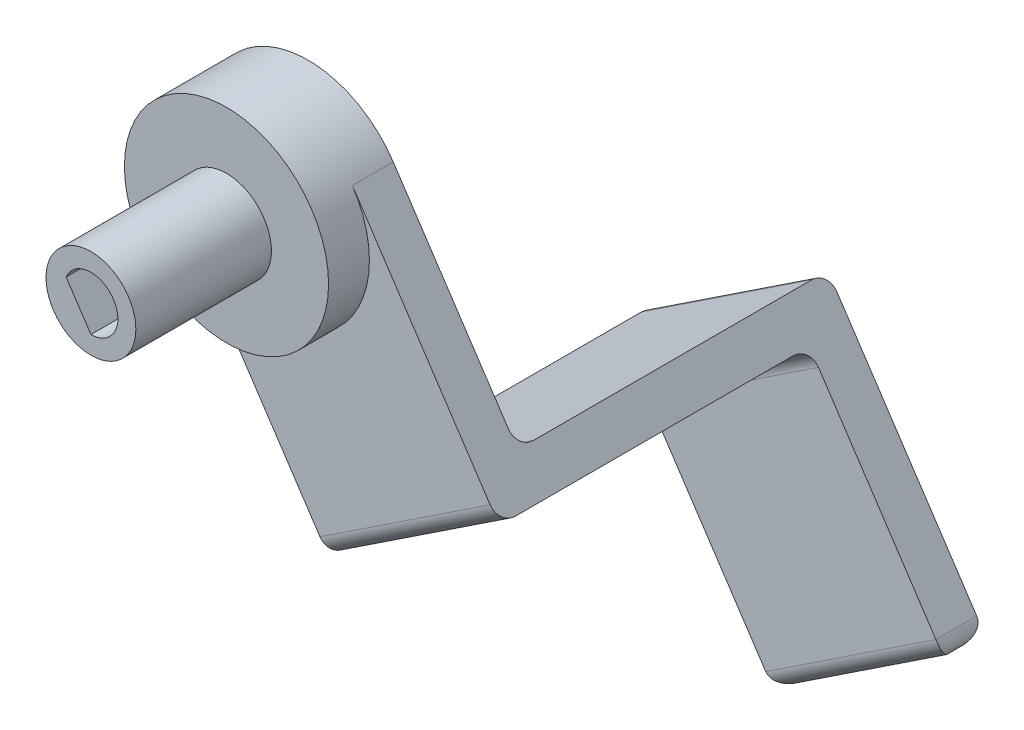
SolidWorks part; units mm, degrees
ref_plane "Front Plane" through (0, 0, 0) normal (0, 0, 1) x (1, 0, 0)
ref_plane "Top Plane" through (0, 0, 0) normal (0, 1, 0) x (1, 0, 0)
ref_plane "Right Plane" through (0, 0, 0) normal (1, 0, 0) x (0, 0, -1)
sketch "Sketch1" plane through (0, 0, 0) normal (0, 0, 1) x (1, 0, 0)
  line L0 (0, 0) -> (-3.0402, 4.5833)
  arc A0 (0, 0) -> (-3.0402, 4.5833) centre (0, 3.3) ccw
  circle A2 centre (0, 3.3) radius 5.5
  dimension "D1" = 3.3
  dimension "D3" = 11
  dimension "D2" = 5.5
extrude "Boss-Extrude1" add sketch "Sketch1" along normal blind 6.6
sketch "Sketch5" plane through (0, 0, 0) normal (0, 0, -1) x (-1, 0, 0)
  circle A0 centre (0, 3.3) radius 5.5
  dimension "D1" = 11
  dimension "D2" = 3.3
extrude "Boss-Extrude4" add sketch "Sketch5" along normal blind 10
sketch "Sketch6" plane through (0, 0, -10) normal (0, 0, -1) x (-1, 0, 0)
  circle A0 centre (0, 3.3) radius 12.5
  circle A1 centre (0, 3.3) radius 5.5 construction
  dimension "D1" = 25
extrude "Boss-Extrude5" add sketch "Sketch6" along normal blind 10
ref_plane "Plane3" through (5.3895, -8.125, 0) normal (0.5528, -0.8333, 0) x (-0.8333, -0.5528, 0)
sketch "Sketch25" plane through (5.3895, -8.125, 0) normal (0.5528, -0.8333, 0) x (-0.8333, -0.5528, 0)
  line L0 (10.6759, 10) -> (10.6759, 20) construction
  line L1 (-14.3241, 20) -> (10.6759, 20)
  line L2 (-14.3241, 20) -> (-14.3241, 15)
  line L3 (-14.3241, 15) -> (10.6759, 15)
  line L4 (10.6759, 20) -> (10.6759, 15)
  dimension "D1" = 5
extrude "Boss-Extrude6" add sketch "Sketch25" along normal blind 20 and the other way blind 12.5 contours L4 L3 L2 L1
sketch "Sketch26" plane through (0, 0, -20) normal (0, 0, -1) x (-1, 0, 0)
  line L0 (-28.3817, -16.8737) -> (-25.6179, -12.707)
  line L1 (-10.4167, 10.2096) -> (-28.3817, -16.8737) construction
  line L2 (-25.6179, -12.707) -> (-4.7845, -26.5263)
  line L3 (10.4167, -3.6096) -> (-7.5484, -30.693) construction
  line L4 (-4.7845, -26.5263) -> (-7.5484, -30.693)
  line L5 (-7.5484, -30.693) -> (-28.3817, -16.8737)
  dimension "D1" = 5
extrude "Boss-Extrude7" add sketch "Sketch26" along normal blind 38
sketch "Sketch27" plane through (16.4449, -24.7917, 0) normal (0.5528, -0.8333, 0) x (0.8333, 0.5528, 0)
  line L0 (-10.6759, -58) -> (-10.6759, -15) construction
  line L1 (-10.6759, -53) -> (14.3241, -53)
  line L2 (-10.6759, -53) -> (-10.6759, -58)
  line L3 (-10.6759, -58) -> (14.3241, -58)
  line L4 (14.3241, -53) -> (14.3241, -58)
  dimension "D1" = 5
extrude "Boss-Extrude8" add sketch "Sketch27" along normal blind 30
fillet "Fillet1" radius 2 8 edges at (24.1315, -55.693, -55.5) (44.9648, -41.8737, -55.5) (34.5482, -48.7833, -53) (34.5482, -48.7833, -58) (15.2012, -19.6167, -20) (17.9651, -23.7833, -15) (15.2012, -19.6167, -58) (17.9651, -23.7833, -53)
